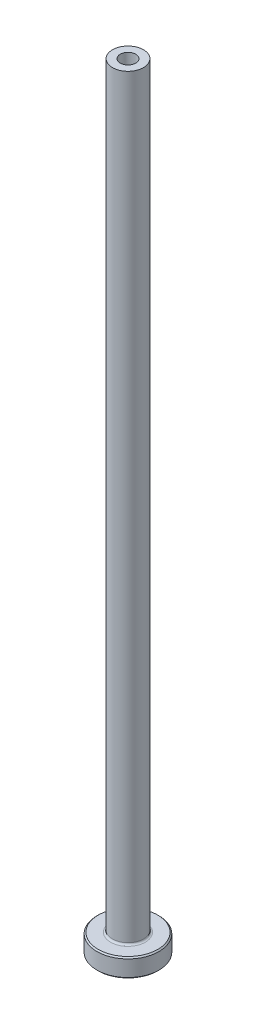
SolidWorks part; units mm, degrees
ref_plane "Front Plane" through (0, 0, 0) normal (0, 0, 1) x (1, 0, 0)
ref_plane "Top Plane" through (0, 0, 0) normal (0, 1, 0) x (1, 0, 0)
ref_plane "Right Plane" through (0, 0, 0) normal (1, 0, 0) x (0, 0, -1)
sketch "Sketch1" plane through (0, 0, 0) normal (0, 0, 1) x (1, 0, 0)
  line L0 (-1.25, 125) -> (-2.5, 125)
  line L1 (-2.5, 125) -> (-2.5, 3)
  line L2 (-2.5, 3) -> (-5, 3)
  line L3 (-5, 3) -> (-5, 0)
  line L4 (5.5, 0) -> (-5.5, 0) construction
  line L5 (-5, 0) -> (-1.5, 0)
  line L6 (-1.25, 90) -> (-1.25, 125)
  line L7 (0, 92.1877) -> (0, -15.5353) construction
  line L8 (0, -5.5) -> (0, 5.5) construction
  line L9 (-1.25, 90) -> (-1.5, 78)
  line L10 (-1.5, 78) -> (-1.5, 0)
  dimension "D1" = 0.25
  dimension "ID" = 2.5
  dimension "OD" = 5
  dimension "L" = 125
  dimension "H" = 10
  dimension "T" = 3
  dimension "N" = 35
  dimension "D2" = 12
revolve "Revolve1" add sketch "Sketch1" angle 360 about L7
fillet "Fillet1" radius 0.3 1 edges at (0, 3, 2.5)
chamfer "Chamfer1" distance 0.2 angle 45 2 edges at (0, 3, 5) (0, 0, 5)
chamfer "Chamfer3" distance 0.5 angle 45 1 edges at (0, 0, 1.5)
